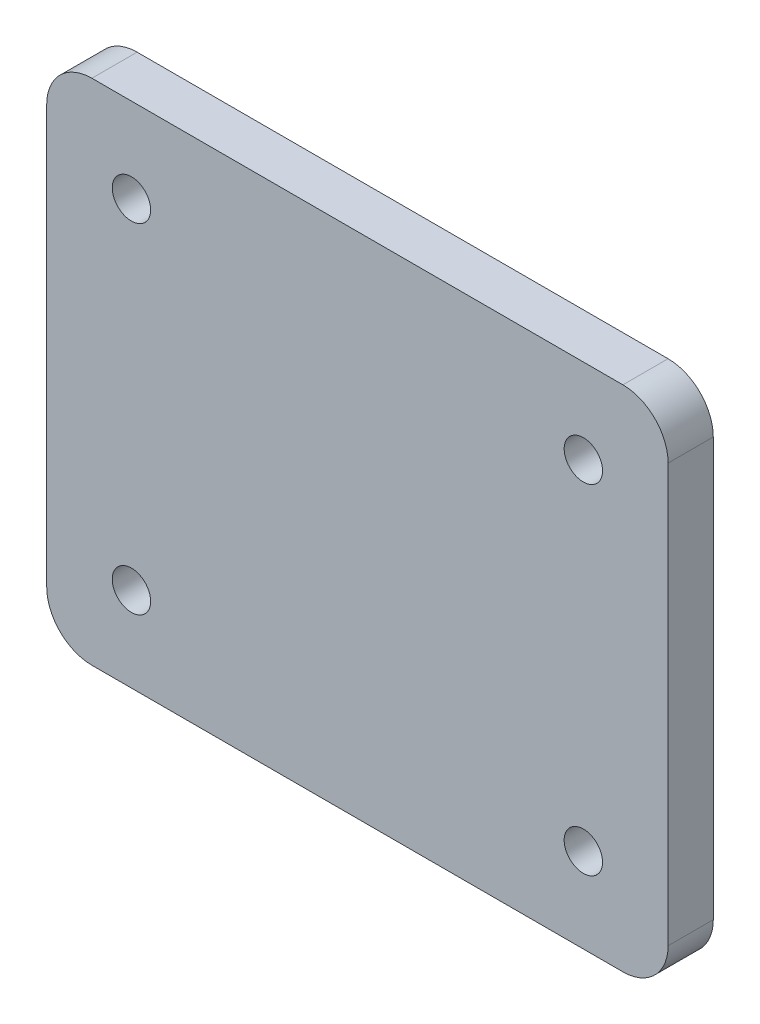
SolidWorks part; units mm, degrees
ref_plane "Ebene vorne" through (0, 0, 0) normal (0, 0, 1) x (1, 0, 0)
ref_plane "Ebene oben" through (0, 0, 0) normal (0, 1, 0) x (1, 0, 0)
ref_plane "Ebene rechts" through (0, 0, 0) normal (1, 0, 0) x (0, 0, -1)
sketch "Skizze1" plane through (0, 0, 0) normal (0, 0, 1) x (1, 0, 0)
  line L0 (55, 90) -> (55, 45) construction
  line L1 (55, 45) -> (110, 45) construction
  line L64 (110, 8) -> (110, 82)
  line L65 (0, 8) -> (0, 82)
  line L66 (102, 0) -> (8, 0)
  line L67 (102, 90) -> (8, 90)
  circle A128 centre (15, 15) radius 2.5
  circle A129 centre (15, 75) radius 2.5
  circle A130 centre (95, 75) radius 2.5
  circle A131 centre (95, 15) radius 2.5
  arc A132 (0, 8) -> (8, 0) centre (8, 8) ccw
  arc A133 (8, 90) -> (0, 82) centre (8, 82) ccw
  arc A134 (110, 82) -> (102, 90) centre (102, 82) ccw
  arc A135 (102, 0) -> (110, 8) centre (102, 8) ccw
  point P0 (0, 0)
  dimension "D4" = 8
  dimension "D5" = 60
  dimension "D6" = 5
  dimension "D1" = 90
  dimension "D2" = 110
  dimension "D3" = 80
extrude "Linear austragen1" add sketch "Skizze1" against normal blind 8
hole_wizard "M8 Gewindebohrung1" positions "3D-Skizze1" profile "Skizze2" tap size "M8" standard "DIN"
sketch3d "3D-Skizze1"
  point P0 (15, 75, 0)
  point P20 (15, 15, 0)
  point P22 (95, 15, 0)
  point P24 (95, 75, 0)
sketch "Skizze2" plane through (15, 75, 0) normal (1, 0, 0) x (0, -1, 0)
  line L0 (0, 0) -> (0, 8)
  line L1 (0, 8) -> (3.4, 8)
  line L2 (3.4, 8) -> (3.4, 0)
  line L5 (3.4, 0) -> (0, 0)
  line L11 (0, -6.35) -> (0, 107.95) construction
  dimension "Bohrerdurchmesser" = 6.8
  dimension "Bohrungstiefe" = 8
equation "\"LÄNGE\"=0"
equation "\"BREITE\"=0"
equation "\"HÖHE\"=0"
equation "\"DURCHMESSER\"=0"
equation "\"Stückzahl\"= 1"
